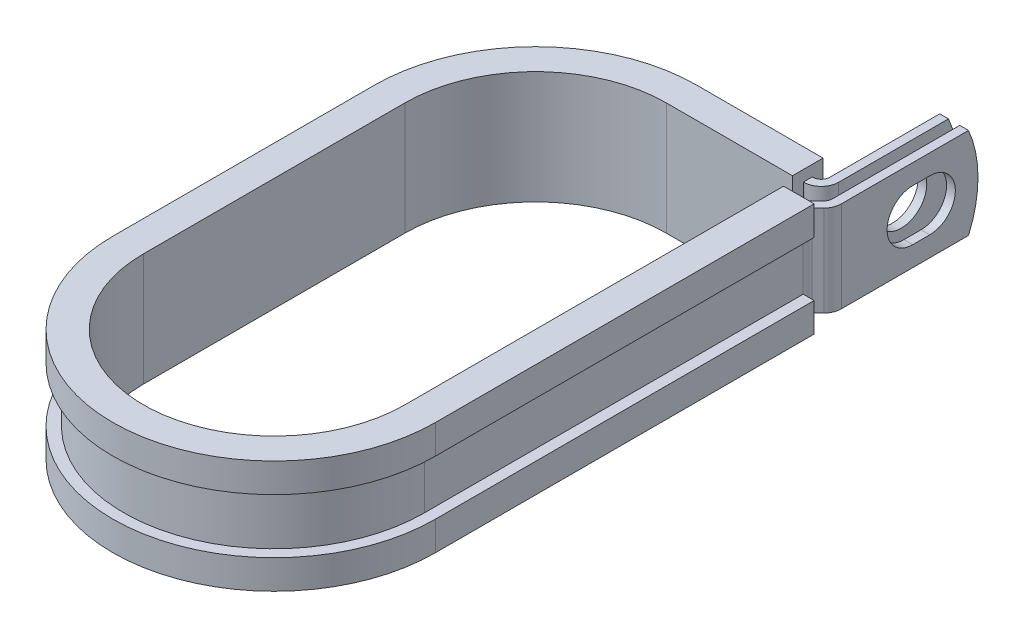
SolidWorks part; units mm, degrees
ref_plane "Front Plane" through (0, 0, 0) normal (0, 0, 1) x (1, 0, 0)
ref_plane "Top Plane" through (0, 0, 0) normal (0, 1, 0) x (1, 0, 0)
ref_plane "Right Plane" through (0, 0, 0) normal (1, 0, 0) x (0, 0, -1)
sketch "Sketch1" plane through (0, 0, 0) normal (0, 1, 0) x (1, 0, 0)
  line L0 (0, 19.7739) -> (17.6582, 19.7739)
  line L1 (19.7739, 0) -> (19.7739, 16.3614)
  line L2 (20.0966, 38.862) -> (20.0966, 22.2123)
  line L3 (20.4881, 18.0856) -> (21.3143, 18.9118)
  line L4 (-19.7739, 0) -> (-19.7739, -36.4998)
  line L5 (21.6714, 19.7739) -> (21.6714, 38.862)
  line L6 (19.7739, 0) -> (19.7739, -36.4998)
  arc A0 (0, 19.7739) -> (-19.7739, 0) centre (0, 0) ccw
  arc A1 (20.4881, 18.0856) -> (19.7739, 16.3614) centre (22.2123, 16.3614) ccw
  arc A2 (21.3143, 18.9118) -> (21.6714, 19.7739) centre (20.4522, 19.7739) ccw
  arc A3 (17.6582, 19.7739) -> (20.0966, 22.2123) centre (17.6582, 22.2123) ccw
  arc A4 (-19.7739, -36.4998) -> (19.7739, -36.4998) centre (0, -36.4998) ccw
extrude "Extrude-Thin1" add sketch "Sketch1" along normal mid plane 12.7 thin
sketch "Sketch2" plane through (18.8774, 0, 0) normal (-1, 0, 0) x (0, 0, 1)
  line L0 (-38.862, 6.35) -> (-38.862, -6.35) construction
  line L1 (0, 6.35) -> (0, -6.35) construction
  circle A0 centre (-30.9372, 0) radius 3.5687
  point P2 (-38.862, 0)
extrude "Cut-Extrude1" cut sketch "Sketch2" against normal up to surface (1.2192 mm away)
sketch "Sketch3" plane through (22.8906, 0, 0) normal (1, 0, 0) x (0, 0, -1)
  line L0 (29.7434, 0) -> (32.131, 0) construction
  line L1 (29.7434, 3.5687) -> (32.131, 3.5687)
  line L2 (29.7434, -3.5687) -> (32.131, -3.5687)
  line L3 (38.862, 6.35) -> (38.862, -6.35) construction
  arc A0 (29.7434, 3.5687) -> (29.7434, -3.5687) centre (29.7434, 0) ccw
  arc A1 (32.131, -3.5687) -> (32.131, 3.5687) centre (32.131, 0) ccw
  point P3 (30.9372, 0)
  point P8 (38.862, 0)
  point P11 (26.1747, 0)
  point P12 (35.6997, 0)
extrude "Cut-Extrude2" cut sketch "Sketch3" against normal up to surface (1.2192 mm away)
sketch "Sketch4" plane through (18.8774, 0, 0) normal (-1, 0, 0) x (0, 0, 1)
  line L0 (-38.862, 6.35) -> (-38.862, -6.35)
  line L1 (-38.862, 6.35) -> (-37.5367, 6.35)
  line L2 (-38.862, 6.35) -> (-22.2123, 6.35) construction
  line L3 (-38.862, -6.35) -> (-37.5367, -6.35)
  line L4 (-38.862, -6.35) -> (-22.2123, -6.35) construction
  arc A0 (-37.5367, 6.35) -> (-37.5367, -6.35) centre (-22.987, 0) ccw
extrude "Cut-Extrude3" cut sketch "Sketch4" against normal through all contours A0 M4 M5 | A0 L0 M2
ref_plane "Plane1" through (0, 0, -16.3614) normal (0, 0, -1) x (-1, 0, 0)
ref_plane "Plane2" through (17.6074, 0, 0) normal (-1, 0, 0) x (0, 0, 1)
sketch "Sketch5" plane through (0, 0, -16.3614) normal (0, 0, -1) x (-1, 0, 0)
  line L0 (-20.9931, 6.35) -> (-19.7739, 6.35)
  line L1 (-20.9931, 6.35) -> (-20.9931, -6.35) construction
  line L3 (-19.7739, 6.35) -> (-19.7739, -6.35)
  line L4 (-19.7739, -6.35) -> (-20.9931, -6.35)
  line L5 (-20.9931, -6.35) -> (-20.9931, -3.81)
  line L6 (-20.9931, 6.35) -> (-20.9931, 3.81)
  line L7 (-22.5171, 7.874) -> (-22.5171, 3.81)
  line L8 (-22.5171, 7.874) -> (-18.2499, 7.874)
  line L9 (-18.2499, 7.874) -> (-18.2499, -7.874)
  line L10 (-18.2499, -7.874) -> (-22.5171, -7.874)
  line L11 (-22.5171, -7.874) -> (-22.5171, -3.81)
  line L12 (-22.5171, 3.81) -> (-20.9931, 3.81)
  line L13 (-20.9931, -3.81) -> (-22.5171, -3.81)
sketch "Sketch6" plane through (0, 6.35, 0) normal (0, 1, 0) x (1, 0, 0)
  line L0 (18.2499, 0) -> (18.2499, 16.3614)
  line L1 (18.2499, 16.3614) -> (22.5171, 16.3614) construction
  line L2 (17.6074, 6.9878) -> (17.6074, -6.9878) construction
  line L3 (18.2499, -36.4998) -> (18.2499, 0)
  line L4 (-18.2499, -36.4998) -> (-18.2499, 0)
  line L5 (0, 18.2499) -> (17.6074, 18.2499)
  arc A0 (0, 18.2499) -> (-18.2499, 0) centre (0, 0) ccw
  arc A1 (-18.2499, -36.4998) -> (18.2499, -36.4998) centre (0, -36.4998) ccw
sweep "Sweep1" add profiles "Sketch5" path "Sketch6"
equation "\"D4@Sketch5\" = \"D1@Extrude-Thin1\""
equation "\"D5@Sketch5\" = \"D5@Extrude-Thin1\""
equation "\"D1@Sketch3\" = \"D2@Sketch2\""
equation "\"D7@Sketch1\" = \"D3@Sketch2\" + \"D1@Sketch3\""
equation "\"D1@Sketch1\" = \"D1@Sketch6\" + 2 * \"D3@Sketch5\""
equation "\"D1@Sketch4\" = ( \"D1@Extrude-Thin1\" + .125 ) * 2"
equation "\"D9@Sketch1\"= \"D5@Extrude-Thin1\""
equation "\"D8@Sketch1\"= 2 * \"D5@Extrude-Thin1\""
equation "\"D2@Sketch1\" = 2 * \"D5@Extrude-Thin1\""
equation "\"D2@Sketch3\" = \"D1@Sketch2\""
equation "\"D6@Sketch1\" = \"D1@Sketch1\""
equation "\"D3@Sketch1\" = \"D1@Sketch6\""
